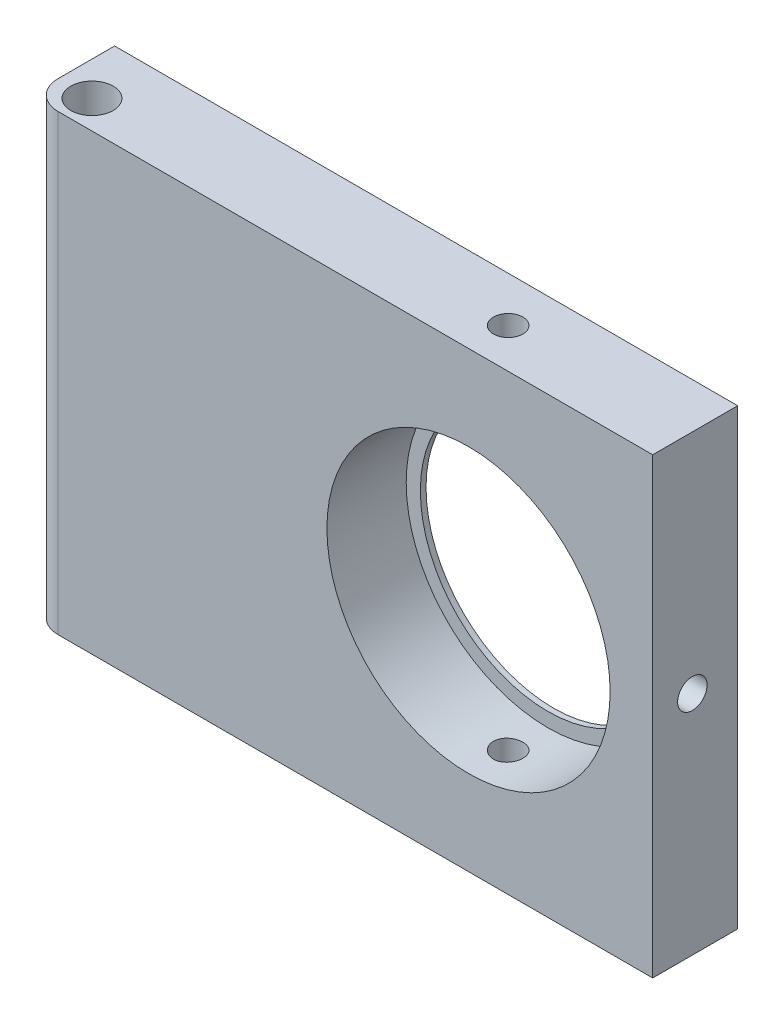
SolidWorks part; units mm, degrees
ref_plane "front" through (0, 0, 0) normal (0, 0, 1) x (1, 0, 0)
ref_plane "top" through (0, 0, 0) normal (0, 1, 0) x (1, 0, 0)
ref_plane "right" through (0, 0, 0) normal (1, 0, 0) x (0, 0, -1)
sketch "Sketch1" plane through (0, 0, 0) normal (0, 0, 1) x (1, 0, 0)
  line L0 (-38.1, -25.4) -> (31.75, -25.4)
  line L1 (-38.1, -25.4) -> (-38.1, 25.4)
  line L2 (31.75, 25.4) -> (-38.1, 25.4)
  line L3 (31.75, 25.4) -> (31.75, -25.4)
  dimension "D1" = 50.8
  dimension "D2" = 69.85
  dimension "D3" = 31.75
  dimension "D4" = 25.4
extrude "Base-Extrude" add sketch "Sketch1" along normal blind 9.525
sketch "Sketch2" plane through (0, 0, 9.525) normal (0, 0, 1) x (1, 0, 0)
  line L0 (-35.7695, 0) -> (35.2206, 0) construction
  circle A0 centre (11.0998, 0) radius 15.875
  dimension "D1" = 31.75
  dimension "D2" = 11.0998
extrude "Cut-Extrude2" cut sketch "Sketch2" against normal blind 8.89
sketch "Sketch3" plane through (0, 0, 0.635) normal (0, 0, 1) x (1, 0, 0)
  circle A0 centre (11.0998, 0) radius 14.2875
  dimension "D1" = 28.575
extrude "Cut-Extrude3" cut sketch "Sketch3" against normal through all
sketch "Sketch4" plane through (0, -25.4, 0) normal (0, -1, 0) x (1, 0, 0)
  line L0 (31.75, 0) -> (-38.1, 0) construction
  line L1 (-38.1, 9.525) -> (-38.1, 0) construction
  circle A0 centre (-34.29, 6.35) radius 2.3749
  dimension "D1" = 4.7498
  dimension "D2" = 6.35
  dimension "D3" = 3.81
extrude "Cut-Extrude4" cut sketch "Sketch4" against normal through all
sketch "Sketch5" plane through (0, 25.4, 0) normal (0, 1, 0) x (-1, 0, 0)
  circle A0 centre (-11.0998, 5.08) radius 1.651
  dimension "D1" = 3.302
  dimension "D2" = 20.6502
  dimension "D3" = 4.445
extrude "Cut-Extrude5" cut sketch "Sketch5" against normal through all
sketch "Sketch6" plane through (31.75, 0, 0) normal (1, 0, 0) x (0, 0, -1)
  line L1 (17.9314, 0) -> (-27.3545, 0) construction
  line L2 (-0.635, 0) -> (-9.525, 0) construction
  circle A0 centre (-5.08, 0) radius 1.651
  dimension "D1" = 3.302
  dimension "D2" = 4.445
extrude "Cut-Extrude8" cut sketch "Sketch6" against normal up to next
fillet "Fillet1" radius 3.175
